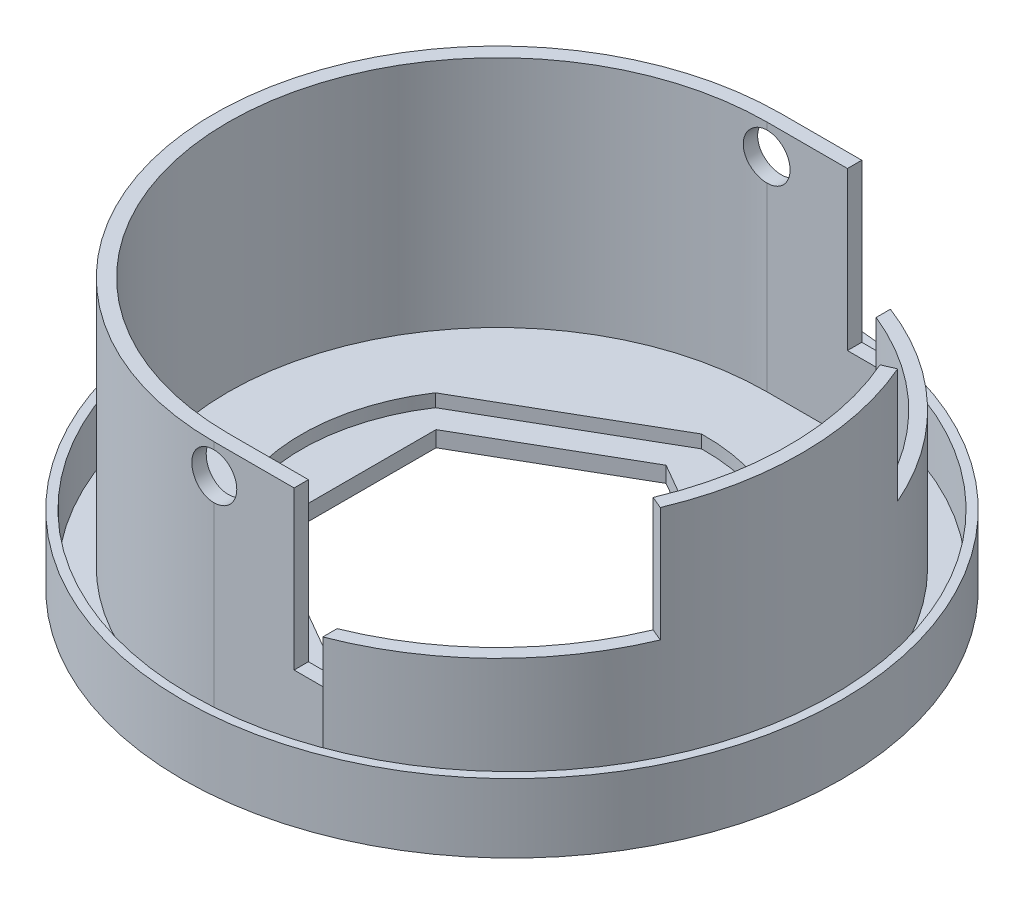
SolidWorks part; units mm, degrees
ref_plane "前视基准面" through (0, 0, 0) normal (0, 0, 1) x (1, 0, 0)
ref_plane "上视基准面" through (0, 0, 0) normal (0, 1, 0) x (1, 0, 0)
ref_plane "右视基准面" through (0, 0, 0) normal (1, 0, 0) x (0, 0, -1)
sketch "草图2" plane through (0, 0, 0) normal (0, 1, 0) x (1, 0, 0)
  line L1 (-25, 25) -> (25, 25)
  line L2 (-25, 25) -> (-25, -25)
  line L3 (-25, -25) -> (25, -25)
  line L4 (25, 25) -> (25, -25)
  line L5 (-25, 25) -> (25, -25) construction
  line L6 (-25, -25) -> (25, 25) construction
  point P0 (0, 0)
extrude "凸台-拉伸2" add sketch "草图2" along normal blind 2
extrude "切除-拉伸4" cut sketch "草图6" against normal up to surface (2 mm away)
sketch "草图6" plane through (19.5662, 2, 0) normal (0, 1, 0) x (1, 0, 0)
  line L0 (-19.5662, -18.5) -> (-11.9669, -18.5)
  line L2 (-11.9669, 18.5) -> (-19.5662, 18.5)
  line L8 (-51.0686, 28.8755) -> (17.3497, 28.8755)
  line L9 (-51.0686, 28.8755) -> (-51.0686, -33.6721)
  line L10 (-51.0686, -33.6721) -> (17.3497, -33.6721)
  line L11 (17.3497, 28.8755) -> (17.3497, -33.6721)
  arc A0 (-19.5662, -18.5) -> (-19.5662, 18.5) centre (-19.5662, 0) cw
  arc A1 (-11.9669, 18.5) -> (-11.9669, -18.5) centre (-19.5662, 0) cw
extrude "切除-拉伸5" cut sketch "草图7" against normal up to surface (2 mm away)
sketch "草图7" plane through (19.5662, 0, 0) normal (0, -1, 0) x (-1, 0, 0)
  line L1 (19.5662, 11.7491) -> (9.3912, 5.8745)
  line L2 (9.3912, 5.8745) -> (9.3912, -5.8745)
  line L3 (9.3912, -5.8745) -> (19.5662, -11.7491)
  line L4 (19.5662, -11.7491) -> (29.7412, -5.8745)
  line L5 (29.7412, -5.8745) -> (29.7412, 5.8745)
  line L6 (29.7412, 5.8745) -> (19.5662, 11.7491)
  circle A0 centre (19.5662, 0) radius 10.175 construction
sketch "草图8" plane through (0, 2, 0) normal (0, 1, 0) x (1, 0, 0)
  line L0 (12.375, 6.8) -> (12.375, -6.8)
  line L2 (0.2519, -13.973) -> (-11.5261, -7.173)
  line L4 (-11.5261, 7.173) -> (0.2519, 13.973)
  line L6 (10.175, 5.8745) -> (10.175, -5.8745) construction
  line L7 (-10.175, 5.8745) -> (0, 11.7491) construction
  line L8 (0, -11.7491) -> (-10.175, -5.8745) construction
  arc A0 (0.2519, -13.973) -> (12.375, -6.8) centre (0.4487, -0.4744) ccw
  arc A1 (12.375, 6.8) -> (0.2519, 13.973) centre (0.4487, 0.4744) ccw
  arc A2 (-11.5261, 7.173) -> (-11.5261, -7.173) centre (-0.6841, 0) ccw
  point P8 (10.175, 0)
  point P9 (12.375, 0)
  dimension "D7" = 13.5
  dimension "D8" = 13.5
  dimension "D9" = 13
  dimension "D1" = 13.6
  dimension "D2" = 13.6
  dimension "D3" = 13.6
  dimension "D4" = 2.2
  dimension "D5" = 1.8
  dimension "D6" = 1.8
extrude "切除-拉伸6" cut sketch "草图8" against normal blind 0.9
sketch "草图9" plane through (0, 2, 0) normal (0, 1, 0) x (1, 0, 0)
  line L0 (7.5993, 18.8) -> (0, 18.8)
  line L1 (7.5993, 18.5) -> (0, 18.5) construction
  line L2 (0, -18.8) -> (7.5993, -18.8)
  line L4 (0, 18.5) -> (7.5993, 18.5)
  line L5 (7.5993, -18.5) -> (0, -18.5)
  arc A0 (0, 18.8) -> (0, -18.8) centre (0, 0) ccw
  arc A1 (7.5993, 18.8) -> (7.5993, -18.8) centre (0, 0) cw
  arc A2 (0, 18.5) -> (0, -18.5) centre (0, 0) ccw
  arc A3 (7.5993, 18.5) -> (7.5993, -18.5) centre (0, 0) cw
  arc A10 (7.5993, -18.5) -> (7.5993, 18.5) centre (0, 0) ccw construction
  dimension "D1" = 0.3
extrude "凸台-拉伸3" add sketch "草图9" against normal up to surface (2 mm away)
sketch "草图11" plane through (0, 2, 0) normal (0, 1, 0) x (1, 0, 0)
  line L0 (7.5993, 19.8) -> (0, 19.8)
  line L2 (0, -19.8) -> (7.5993, -19.8)
  line L3 (7.5993, 18.8) -> (0, 18.8) construction
  line L4 (0, -18.8) -> (7.5993, -18.8) construction
  line L5 (0, 18.8) -> (7.5993, 18.8)
  line L6 (7.5993, -18.8) -> (0, -18.8)
  arc A0 (0, 19.8) -> (0, -19.8) centre (0, 0) ccw
  arc A1 (7.5993, -19.8) -> (7.5993, 19.8) centre (0, 0) ccw
  arc A2 (0, 18.8) -> (0, -18.8) centre (0, 0) ccw
  arc A3 (7.5993, 18.8) -> (7.5993, -18.8) centre (0, 0) cw
  arc A4 (7.5993, -18.8) -> (7.5993, 18.8) centre (0, 0) ccw construction
  dimension "D1" = 1
  dimension "D2" = 1
extrude "凸台-拉伸4" add sketch "草图11" along normal blind 16.3 and the other way up to surface (2 mm away)
sketch "草图12" plane through (0, 18.3, 0) normal (0, 1, 0) x (1, 0, 0)
  line L0 (0, -19.8) -> (7.5993, -19.8) construction
  line L1 (7.5993, 19.8) -> (5.5993, 19.8)
  line L2 (7.5993, 19.8) -> (7.5993, -19.8)
  line L3 (7.5993, -19.8) -> (5.5993, -19.8)
  line L4 (5.5993, 19.8) -> (5.5993, -19.8)
  dimension "D1" = 2
extrude "切除-拉伸8" cut sketch "草图12" against normal blind 11
sketch "草图13" plane through (0, 0, 0) normal (0, -1, 0) x (-1, 0, 0)
  circle A1 centre (-1, 0) radius 23
  circle A2 centre (-1, 0) radius 19.2348
  dimension "D1" = 1
extrude "凸台-拉伸5" add sketch "草图13" against normal blind 0.8
sketch "草图14" plane through (0, 0.8, 0) normal (0, 1, 0) x (1, 0, 0)
  circle A0 centre (1, 0) radius 22.4
  circle A1 centre (1, 0) radius 23
extrude "凸台-拉伸6" add sketch "草图14" along normal blind 4
extrude "切除-拉伸9" cut sketch "草图15" against normal blind 1.2
sketch "草图15" plane through (19.5662, 18.4506, -19.8) normal (0, 0, -1) x (-1, 0, 0)
  circle A0 centre (19.5662, -2.2381) radius 1.6
extrude "切除-拉伸10" cut sketch "草图16" against normal blind 1.2
sketch "草图16" plane through (19.5662, 18.4506, 19.8) normal (0, 0, 1) x (1, 0, 0)
  circle A0 centre (-19.5662, -2.2381) radius 1.6
sketch "草图17" plane through (0, 0, 0) normal (0, -1, 0) x (-1, 0, 0)
  circle A0 centre (0, 0) radius 14
  circle A1 centre (0, 0) radius 15
extrude "切除-拉伸11" cut sketch "草图17" against normal blind 0.6
sketch "草图18" plane through (0, 0, 0) normal (0, -1, 0) x (-1, 0, 0)
  circle A0 centre (-22, 0) radius 1.5
  dimension "D1" = 3
  dimension "D2" = 22
extrude "切除-拉伸12" cut sketch "草图18" against normal blind 0.7
sketch "草图19" plane through (0, 18.3, 0) normal (0, 1, 0) x (1, 0, 0)
  line L0 (0, 0) -> (7.7098, 23.3639)
  line L1 (7.7098, 23.3639) -> (27.1211, 11.7749)
  line L2 (27.1211, 11.7749) -> (0, 0)
  line L3 (0, 0) -> (28.0715, -11.7877)
  line L4 (28.0715, -11.7877) -> (8.0713, -24.5647)
  line L5 (8.0713, -24.5647) -> (0, 0)
extrude "切除-拉伸13" cut sketch "草图19" against normal blind 8 contours L3 L4 L5 | L0 L1 L2
sketch "草图20" plane through (0, 0, 0) normal (0, -1, 0) x (1, 0, 0)
  circle A0 centre (0, 0) radius 16.5
  circle A1 centre (0, 0) radius 17
extrude "凸台-拉伸7" add sketch "草图20" along normal blind 3
